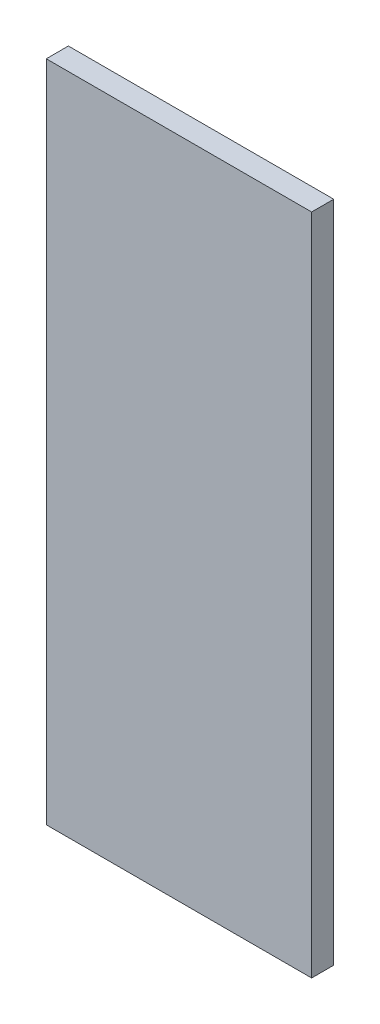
SolidWorks part; units mm, degrees
ref_plane "Front Plane" through (0, 0, 0) normal (0, 0, 1) x (1, 0, 0)
ref_plane "Top Plane" through (0, 0, 0) normal (0, 1, 0) x (1, 0, 0)
ref_plane "Right Plane" through (0, 0, 0) normal (1, 0, 0) x (0, 0, -1)
sketch "Sketch1" plane through (0, 0, 0) normal (0, 0, 1) x (1, 0, 0)
  line L1 (-6, 15) -> (6, 15)
  line L2 (-6, 15) -> (-6, -15)
  line L3 (-6, -15) -> (6, -15)
  line L4 (6, 15) -> (6, -15)
  point P4 (0, 15)
  point P6 (-6, 0)
  dimension "D1" = 12
  dimension "D2" = 30
extrude "Tape" add sketch "Sketch1" along normal blind 1
